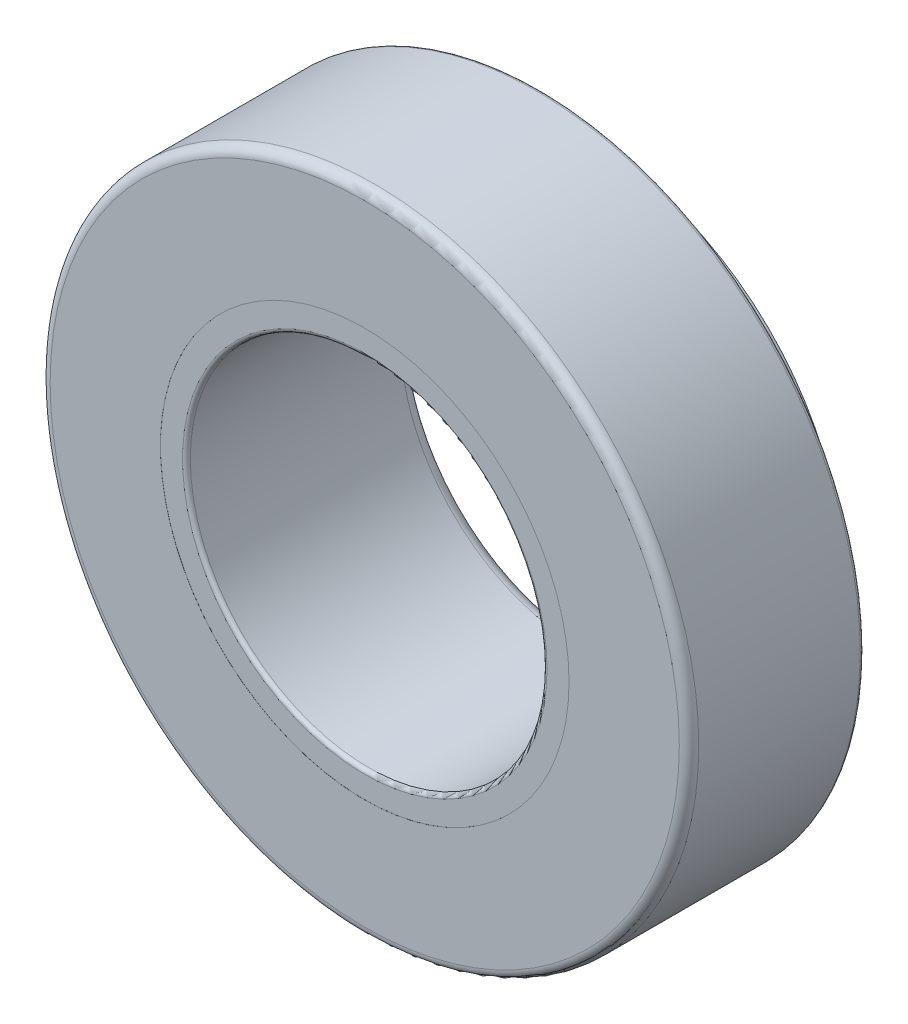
SolidWorks part; units mm, degrees
ref_plane "Face" through (0, 0, 0) normal (0, 0, 1) x (1, 0, 0)
ref_plane "Dessus" through (0, 0, 0) normal (0, 1, 0) x (1, 0, 0)
ref_plane "Droite" through (0, 0, 0) normal (1, 0, 0) x (0, 0, -1)
sketch "E_corps" plane through (0, 0, 0) normal (1, 0, 0) x (0, 0, -1)
  line L0 (-59.9913, 0) -> (114.6539, 0) construction
  line L1 (0.61, 27.5) -> (33, 27.5)
  line L2 (35, 29.5) -> (35, 38.8)
  line L3 (35, 38.8) -> (31, 38.8)
  line L4 (31, 38.8) -> (31, 42.5)
  line L5 (31, 42.5) -> (27, 41.7258)
  line L6 (27, 41.7258) -> (27, 49.4)
  line L7 (0.01, 28.1) -> (0.01, 31.5)
  line L8 (0.01, 31.5) -> (0, 31.5)
  line L9 (0, 31.5) -> (0, 48.5)
  line L10 (1.5, 50) -> (26.4, 50)
  line L11 (3.7831, 109.6208) -> (34.3427, -48.2708) construction
  line L12 (0, 50) -> (0, -50) construction
  line L13 (17.5, 134.2783) -> (17.5, -52.9463) construction
  line L14 (-51.6303, 38.75) -> (132.2269, 38.75) construction
  arc A0 (35, 29.5) -> (33, 27.5) centre (33, 29.5) cw
  arc A1 (0.01, 28.1) -> (0.61, 27.5) centre (0.61, 28.1) ccw
  arc A2 (1.5, 50) -> (0, 48.5) centre (1.5, 48.5) ccw
  arc A3 (27, 49.4) -> (26.4, 50) centre (26.4, 49.4) ccw
  point P23 (25, 0)
  point P30 (17.5, 38.75)
  dimension "Rayon_appui_bi" = 2
  dimension "Rayon" = 0.6
  dimension "Rayon_appui_be" = 1.5
  dimension "Rayon2" = 0.6
  dimension "Diamètre_nominal" = 55
  dimension "Diamètre_extérieur" = 100
  dimension "Largeur_bi" = 34.99
  dimension "Largeur_be" = 27
  dimension "Largeur_tot" = 35
  dimension "D6" = 4
  dimension "a" = 25
  dimension "d1" = 77.6
  dimension "da_max" = 63
  dimension "D5" = 15
revolve "Corps" add sketch "E_corps" angle 360 about L0
sketch "E_symbole1" plane through (0, 0, 0) normal (1, 0, 0) x (0, 0, -1)
  line L0 (61.8802, 48.4768) -> (-31.0544, 30.4895) construction
  line L1 (31, 42.5) -> (27, 41.7258) construction
  line L2 (0.0289, 36.5005) -> (0.027, 36.5103)
  line L3 (0.027, 36.5103) -> (26.9711, 41.7253)
  line L4 (0.0289, 36.5005) -> (26.973, 41.7155)
  line L5 (26.9711, 41.7253) -> (26.973, 41.7155)
  line L6 (0, 31.5) -> (0, 48.5) construction
  line L7 (27, 41.7258) -> (27, 49.4) construction
  line L8 (-40.1229, 0) -> (90.0965, 0) construction
  line L9 (-59.9913, 0) -> (114.6539, 0) construction
  point P7 (0.028, 36.5054)
  point P10 (26.972, 41.7204)
  dimension "D1" = 0.01
  dimension "D2" = 0.027
  dimension "D3" = 0.027
revolve "Symbole1" cut sketch "E_symbole1" angle 360 about L8
sketch "E_sybole2" plane through (0, 0, 0) normal (1, 0, 0) x (0, 0, -1)
  line L0 (-22.4331, 26.4338) -> (81.0085, 46.4548) construction
  line L1 (61.8802, 48.4768) -> (-31.0544, 30.4895) construction
  line L2 (0.027, 36.5103) -> (26.9711, 41.7253) construction
  line L3 (17.5, 75.5839) -> (17.5, 12.4558) construction
  line L4 (-18.897, 0) -> (91.6132, 0) construction
  line L5 (0, 31.5) -> (0, 48.5) construction
  line L6 (5.9975, 93.5925) -> (22.2315, 9.7167) construction
  line L7 (-59.9913, 0) -> (114.6539, 0) construction
  line L8 (24.1261, 35.4504) -> (10.872, 32.8851)
  line L9 (24.128, 35.4405) -> (10.8739, 32.8752)
  line L10 (10.872, 32.8851) -> (10.8739, 32.8752)
  line L11 (24.1261, 35.4504) -> (24.128, 35.4405)
  point P12 (17.5, 34.1628)
  point P20 (10.873, 32.8802)
  point P21 (17.501, 34.1579)
  point P22 (17.499, 34.1677)
  dimension "D1" = 5.625
  dimension "D2" = 17.5
  dimension "D3" = 0.01
  dimension "D4" = 13.5
revolve "Symbole2" cut sketch "E_sybole2" angle 360 about L4
equation "\"Rayon2@E_corps\"=\"Rayon@E_corps\""
equation "\"D5@E_corps\" = (2/3)*( ( \"Diamètre_extérieur@E_corps\" - \"Diamètre_nominal@E_corps\" )  / 2 ) "
equation "\"D3@E_symbole1\" = 0.001*\"Largeur_be@E_corps\""
equation "\"D2@E_symbole1\" = \"D3@E_symbole1\""
equation "\"D1@E_sybole2\" =  ( 1 / 4 )  *  (  ( \"Diamètre_extérieur@E_corps\" - \"Diamètre_nominal@E_corps\" )  / 2 ) "
equation "\"D4@E_sybole2\" = 0.5*\"Largeur_be@E_corps\""
equation "\"D2@E_sybole2\" =0.5* \"Largeur_tot@E_corps\""
equation "\"D6@E_corps\" =  ( \"Largeur_tot@E_corps\" - \"Largeur_be@E_corps\" )  / 2"
